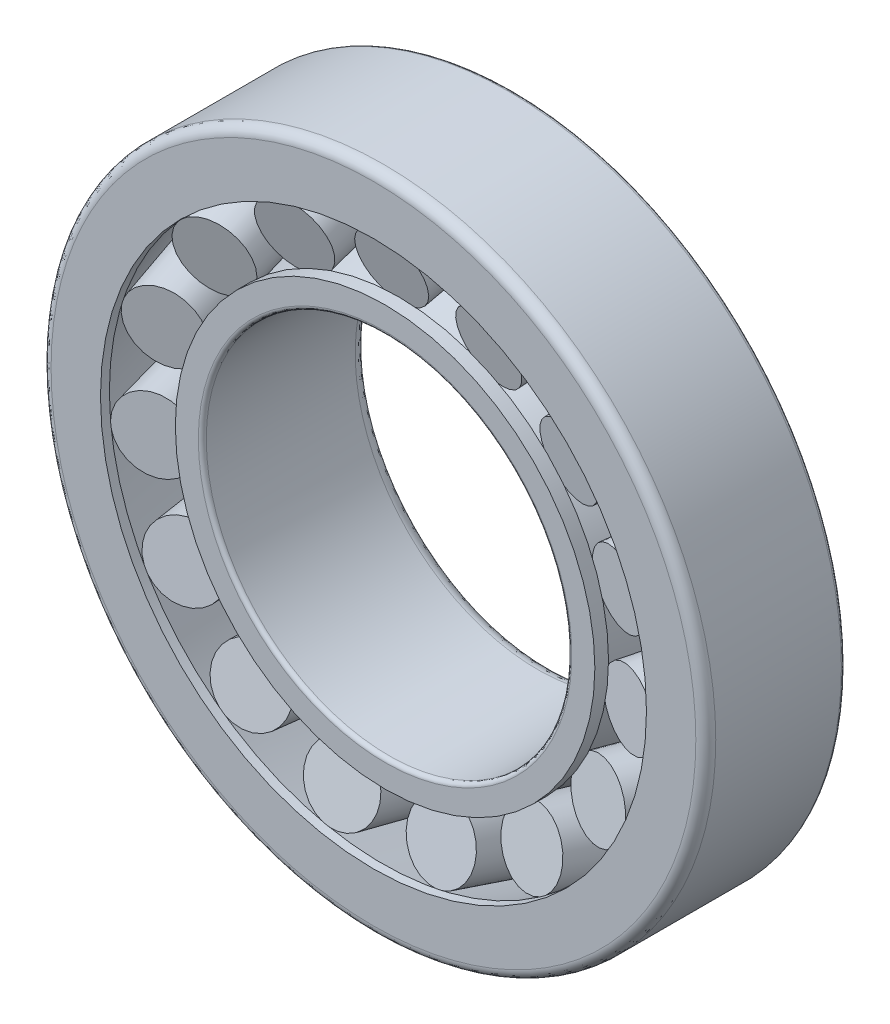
SolidWorks part; units mm, degrees
ref_plane "Front Plane" through (0, 0, 0) normal (0, 0, 1) x (1, 0, 0)
ref_plane "Top Plane" through (0, 0, 0) normal (0, 1, 0) x (1, 0, 0)
ref_plane "Right Plane" through (0, 0, 0) normal (1, 0, 0) x (0, 0, -1)
sketch "BaseSke" plane through (0, 0, 0) normal (1, 0, 0) x (0, 0, -1)
  line L0 (-47.2296, 0) -> (24.6132, 0) construction
  line L2 (0, 129.5214) -> (0, -86.3012) construction
  line L3 (6.7886, 44.1906) -> (-33.5386, 33.3094) construction
  line L4 (-26.75, 50) -> (-5.75, 50) construction
  line L5 (-25, 27.5) -> (0, 27.5) construction
  line L6 (-13.375, 38.75) -> (-20.4266, 64.8845) construction
  line L7 (-25.4125, 41.0943) -> (-7.0875, 46.5572)
  line L8 (-7.0875, 46.5572) -> (-5.5506, 40.8612)
  line L9 (-5.5506, 40.8612) -> (-24.006, 35.8815)
  line L10 (-24.006, 35.8815) -> (-25.4125, 41.0943)
  line L11 (-26.75, 50) -> (-26.75, 41.075) construction
  line L12 (-25.4073, 41.075) -> (-5.75, 46.9351) construction
  line L13 (-5.75, 50) -> (-5.75, 46.9351) construction
  line L14 (-25.4073, 41.075) -> (-26.75, 41.075) construction
  line L15 (-22.5995, 30.6688) -> (-4.0137, 35.1651) construction
  line L16 (-25, 27.5) -> (-25, 31.5604) construction
  line L17 (-25, 31.5604) -> (-22.9436, 31.5604) construction
  line L18 (0, 36.0568) -> (0, 27.5) construction
  line L19 (-22.9436, 31.5604) -> (-22.7097, 30.6935) construction
  line L20 (-22.7097, 30.6935) -> (-3.9295, 35.237) construction
  line L21 (-3.9295, 35.237) -> (-4.1507, 36.0568) construction
  line L22 (-4.1507, 36.0568) -> (0, 36.0568) construction
  dimension "D2" = 13.375
  dimension "D1" = 0.02
  dimension "Outer_Thickness" = 21
  dimension "Bearing_Outside_Diameter" = 100
  dimension "Bearing_Inside_Diameter" = 55
  dimension "Inner_Thickness" = 25
  dimension "Bearing_Thickness" = 26.75
  dimension "Angle" = 15.1
  dimension "D3" = 77.5
  dimension "D4" = 1.3375
  dimension "D5" = 1.3375
  dimension "D6" = 1.5
  dimension "D7" = 0.1
  dimension "Roller_diameter" = 82.15
  dimension "D8" = 0.8917
  dimension "D9" = 0.05
  dimension "D10" = 0.1
  dimension "D11" = 0.8917
revolve "Roller" add sketch "BaseSke" angle 360 about L3
sketch "OuterRaceSke" plane through (0, 0, 0) normal (1, 0, 0) x (0, 0, -1)
  line L0 (-25.4073, 41.075) -> (-26.75, 41.075) construction
  line L1 (-25.4073, 41.075) -> (-5.75, 46.9351) construction
  line L2 (-5.75, 50) -> (-5.75, 46.9351) construction
  line L3 (-26.75, 50) -> (-5.75, 50) construction
  line L4 (-26.75, 50) -> (-26.75, 41.075) construction
  line L5 (-25.4073, 41.075) -> (-26.75, 41.075)
  line L6 (-25.4073, 41.075) -> (-5.75, 46.9351)
  line L7 (-5.75, 50) -> (-5.75, 46.9351)
  line L8 (-26.75, 50) -> (-5.75, 50)
  line L9 (-26.75, 50) -> (-26.75, 41.075)
  line L10 (-60.3939, 0) -> (35.9926, 0) construction
revolve "OuterRace" add sketch "OuterRaceSke" angle 360 about L10
sketch "InnerRaceSke" plane through (0, 0, 0) normal (1, 0, 0) x (0, 0, -1)
  line L0 (-25, 27.5) -> (0, 27.5) construction
  line L1 (-25, 27.5) -> (-25, 31.5604) construction
  line L2 (-25, 31.5604) -> (-22.9436, 31.5604) construction
  line L3 (-22.9436, 31.5604) -> (-22.7097, 30.6935) construction
  line L4 (-22.7097, 30.6935) -> (-3.9295, 35.237) construction
  line L5 (-3.9295, 35.237) -> (-4.1507, 36.0568) construction
  line L6 (-4.1507, 36.0568) -> (0, 36.0568) construction
  line L7 (0, 36.0568) -> (0, 27.5) construction
  line L8 (-25, 27.5) -> (0, 27.5)
  line L9 (-25, 27.5) -> (-25, 31.5604)
  line L10 (-25, 31.5604) -> (-22.9436, 31.5604)
  line L11 (-22.9436, 31.5604) -> (-22.7097, 30.6935)
  line L12 (-22.7097, 30.6935) -> (-3.9295, 35.237)
  line L13 (-3.9295, 35.237) -> (-4.1507, 36.0568)
  line L14 (-4.1507, 36.0568) -> (0, 36.0568)
  line L15 (0, 36.0568) -> (0, 27.5)
  line L16 (-58.1022, 0) -> (39.538, 0) construction
revolve "InnerRace" add sketch "InnerRaceSke" angle 360 about L16
fillet "Fillet1" radius 0.6 2 edges at (50, 0, 5.75) (27.5, 0, 25)
fillet "InnerFillet" radius 2 1 edges at (27.5, 0, 0)
fillet "OuterFillet" radius 1.5 1 edges at (50, 0, 26.75)
pattern_circular "CirPatternBall" count 15 over 360 about axis through (0, 0, 0) along (0, 0, 1) of "Roller"
sketch "Sketch4" plane through (0, 0, 0) normal (1, 0, 0) x (0, 0, -1)
  line L0 (-25.4125, 41.0943) -> (-7.0875, 46.5572)
  line L1 (-7.0875, 46.5572) -> (-4.0137, 35.1651)
  line L2 (-4.0137, 35.1651) -> (-22.5995, 30.6688)
  line L3 (-22.5995, 30.6688) -> (-25.4125, 41.0943)
  line L4 (-40.3293, 0) -> (19.5574, 0) construction
revolve "Simplified" [suppressed] add sketch "Sketch4" angle 360 about L4
equation "\"D2@BaseSke\" = \"Bearing_Thickness@BaseSke\"/2"
equation "\"D3@BaseSke\" =  ( \"Bearing_Outside_Diameter@BaseSke\" + \"Bearing_Inside_Diameter@BaseSke\" )  / 2"
equation "\"Roller_diameter@BaseSke\" = \"D3@BaseSke\"*1.06"
equation "\"D4@BaseSke\" = \"Bearing_Thickness@BaseSke\"/20"
equation "\"D5@BaseSke\" = \"Bearing_Thickness@BaseSke\" / 20"
equation "\"D8@BaseSke\" = \"Bearing_Thickness@BaseSke\"/30"
equation "\"D11@BaseSke\" = \"D8@BaseSke\""
equation "\"D1@CirPatternBall\" = int(  \"D3@BaseSke\" *  pi  /  ( \"Bearing_Outside_Diameter@BaseSke\" - \"Bearing_Inside_Diameter@BaseSke\" )  * 2.8 ) "
